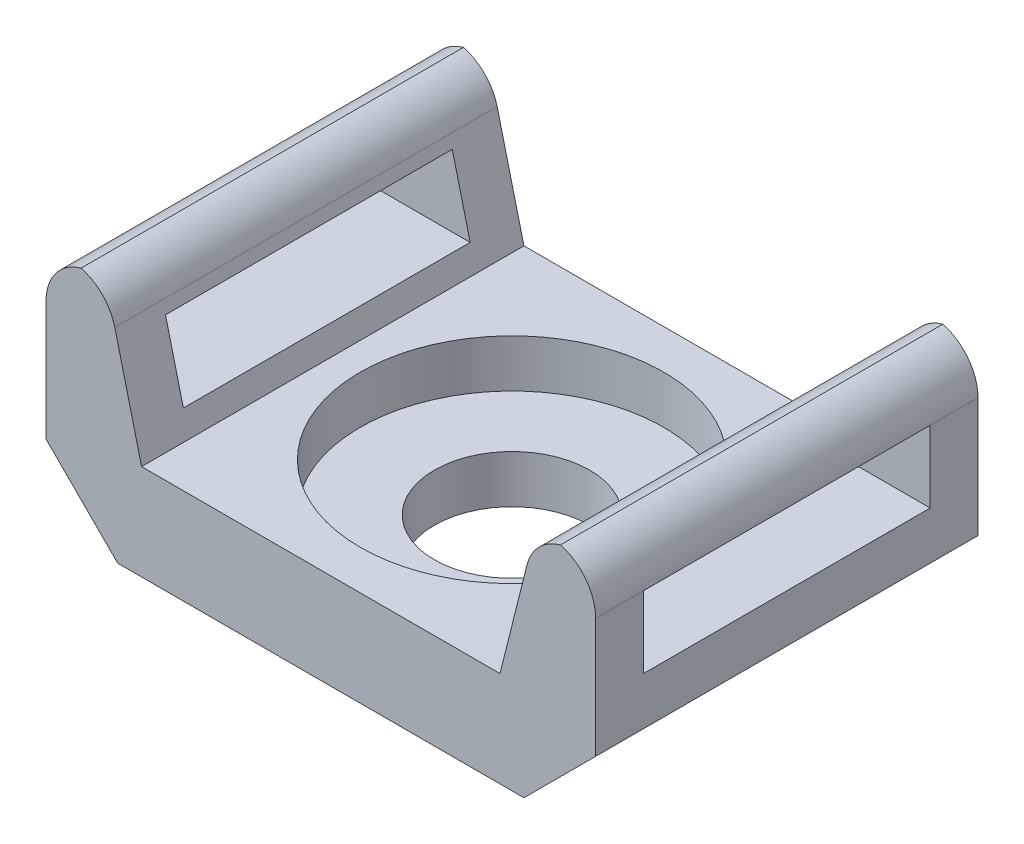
SolidWorks part; units mm, degrees
ref_plane "Ebene vorne" through (0, 0, 0) normal (0, 0, 1) x (1, 0, 0)
ref_plane "Ebene oben" through (0, 0, 0) normal (0, 1, 0) x (1, 0, 0)
ref_plane "Ebene rechts" through (0, 0, 0) normal (1, 0, 0) x (0, 0, -1)
sketch "Skizze1" plane through (0, 0, 0) normal (0, 1, 0) x (1, 0, 0)
  line L1 (-11.5, 8) -> (11.5, 8)
  line L2 (-11.5, 8) -> (-11.5, -8)
  line L3 (-11.5, -8) -> (11.5, -8)
  line L4 (11.5, 8) -> (11.5, -8)
  line L5 (-11.5, 8) -> (11.5, -8) construction
  line L6 (-11.5, -8) -> (11.5, 8) construction
  point P0 (0, 0)
  dimension "D1" = 16
  dimension "D2" = 23
extrude "Aufsatz-Linear austragen1" add sketch "Skizze1" along normal blind 10
sketch "Skizze2" plane through (0, 0, 0) normal (0, 0, 1) x (1, 0, 0)
  line L6 (-7.5, 4) -> (7.5, 4)
  line L7 (7.5, 4) -> (9, 10)
  line L8 (-11.5, 10) -> (11.5, 10) construction
  line L9 (9, 10) -> (-9, 10)
  line L10 (-9, 10) -> (-7.5, 4)
  line L11 (0, -53.599) -> (0, 53.599) construction
  point P6 (0, 10)
  point P9 (0, 4)
  dimension "D1" = 18
  dimension "D2" = 15
  dimension "D3" = 6
extrude "Schnitt-Linear austragen1" cut sketch "Skizze2" against normal through all and the other way through all
sketch "Skizze4" plane through (0, 4, 0) normal (0, 1, 0) x (1, 0, 0)
  circle A0 centre (0, 0) radius 3.25
  dimension "D1" = 6.5
extrude "Schnitt-Linear austragen2" cut sketch "Skizze4" against normal through all
sketch "Skizze5" plane through (0, 4, 0) normal (0, 1, 0) x (1, 0, 0)
  circle A0 centre (0, 0) radius 6.35
  dimension "D1" = 12.7
extrude "Schnitt-Linear austragen3" cut sketch "Skizze5" against normal blind 2
sketch "Skizze6" plane through (0, 0, 0) normal (1, 0, 0) x (0, 0, -1)
  line L0 (0, 53.5395) -> (0, -53.5395) construction
  line L1 (-6, 8) -> (6, 8)
  line L2 (-6, 8) -> (-6, 5)
  line L3 (-6, 5) -> (6, 5)
  line L4 (6, 8) -> (6, 5)
  line L5 (-6, 8) -> (6, 5) construction
  line L6 (-6, 5) -> (6, 8) construction
  line L7 (-8, 10) -> (8, 10) construction
  line L8 (8, 10) -> (8, 0) construction
  point P0 (0, 6.5)
  dimension "D1" = 2
  dimension "D2" = 2
  dimension "D3" = 3
extrude "Schnitt-Linear austragen4" cut sketch "Skizze6" against normal through all and the other way through all
fillet "Verrundung1" radius 2 4 edges at (11.5, 10, 0) (9, 10, 0) (-9, 10, 0) (-11.5, 10, 0)
chamfer "Fase1" distance 3 angle 45 2 edges at (-11.5, 0, 0) (11.5, 0, 0)
